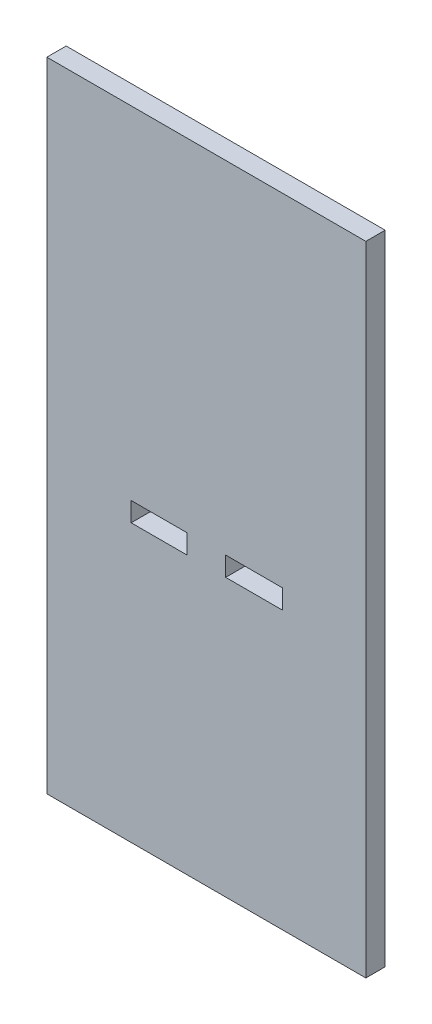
SolidWorks part; units mm, degrees
ref_plane "Front Plane" through (0, 0, 0) normal (0, 0, 1) x (1, 0, 0)
ref_plane "Top Plane" through (0, 0, 0) normal (0, 1, 0) x (1, 0, 0)
ref_plane "Right Plane" through (0, 0, 0) normal (1, 0, 0) x (0, 0, -1)
sketch "Sketch1" plane through (0, 0, 0) normal (0, 0, 1) x (1, 0, 0)
  line L0 (514.6924, 502.0233) -> (498.8682, 502.0233)
  line L1 (449.0334, 597.2733) -> (537.9334, 597.2733)
  line L2 (449.0334, 597.2733) -> (449.0334, 419.4733)
  line L3 (449.0334, 419.4733) -> (537.9334, 419.4733)
  line L4 (537.9334, 597.2733) -> (537.9334, 419.4733)
  line L5 (472.5284, 502.0233) -> (488.0986, 502.0233)
  line L6 (472.5284, 496.6385) -> (472.5284, 502.0233)
  line L7 (488.0986, 502.0233) -> (488.0986, 496.6385)
  line L8 (488.0986, 496.6385) -> (472.5284, 496.6385)
  line L9 (498.8682, 502.0233) -> (498.8682, 496.6385)
  line L10 (514.6924, 496.6385) -> (514.6924, 502.0233)
  line L11 (498.8682, 496.6385) -> (514.6924, 496.6385)
  dimension "D1" = 177.8
  dimension "D2" = 88.9
extrude "Boss-Extrude1" add sketch "Sketch1" along normal blind 5.3848 contours L4 L1 L2 L3 L11 L9 L0 L10 L7 L8 L6 L5
